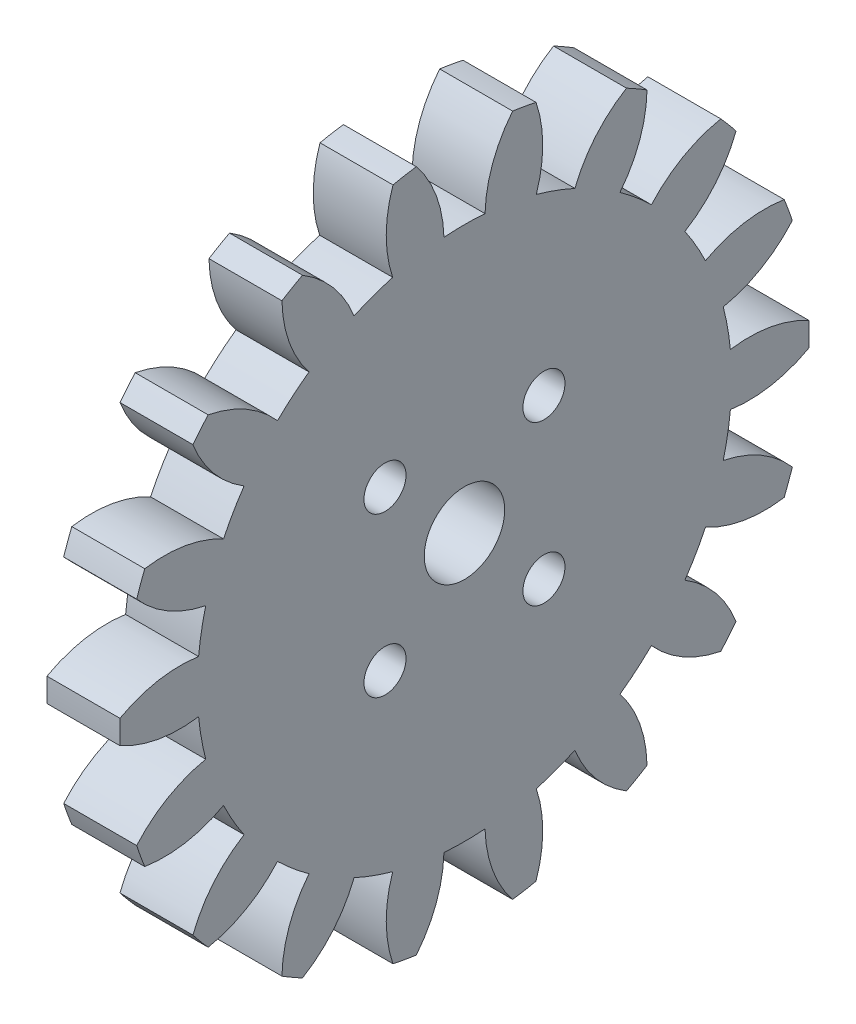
SolidWorks part; units mm, degrees
ref_plane "Plane1" through (0, 0, 0) normal (0, 0, 1) x (1, 0, 0)
ref_plane "Plane2" through (0, 0, 0) normal (0, 1, 0) x (1, 0, 0)
ref_plane "Plane3" through (0, 0, 0) normal (1, 0, 0) x (0, 0, -1)
sketch "HoldingSke" plane through (0, 0, 0) normal (0, 1, 0) x (1, 0, 0)
  line L0 (0, 0) -> (0.317, -0.103)
  line L1 (-15, 0) -> (100, 0) construction
  line L2 (0, 0) -> (-2.1039, 2.3779)
  line L3 (0, 0) -> (-11.863, 4.5341)
  line L4 (0, 0) -> (8.2133, 2.6687)
  line L5 (0, 0) -> (-46.8476, -17.4728)
  line L6 (0, 0) -> (-5.2639, -3.5516)
  line L7 (-2.1039, 2.3779) -> (8.6586, 51.2059)
  line L8 (-76.2, 54.61) -> (-75.2, 54.61)
  line L9 (-67.7845, 28.3722) -> (-49.3413, 33.142)
  line L10 (-76.2, 71.12) -> (104.1128, 71.12)
  line L11 (0, 0) -> (-6.35, 0)
  line L12 (-76.2, 101.6) -> (-76.093, 101.6)
  line L13 (24.9733, 27.94) -> (52.9518, 28.4284)
  line L14 (24.9733, 27.94) -> (24.9743, 27.94)
  line L15 (24.9733, 27.94) -> (100.4006, 29.5858)
  line L16 (-63.627, -3) -> (-12.827, -3)
  circle A0 centre (0, 0) radius 3.5
  circle A1 centre (0, 0) radius 23.249
  circle A2 centre (0, 0) radius 37.5
  circle A3 centre (0, 0) radius 3.5
sketch "BasProSke" plane through (0, 0, 0) normal (0, 1, 0) x (1, 0, 0)
  line L0 (-10, 0) -> (60, 0) construction
  line L1 (0, 0) -> (0, 30)
  line L2 (0, 0) -> (6.35, 0)
  line L3 (6.35, 0) -> (6.35, 30)
  line L4 (6.35, 30) -> (0, 30)
revolve "Base-Revolve" add sketch "BasProSke" angle 360 about L0
sketch "TooCutSke" plane through (0, 0, 0) normal (1, 0, 0) x (0, 0, -1)
  line L1 (0, 0) -> (0, 107) construction
  line L2 (0, 0) -> (-2.5403, 26.8802) construction
  line L3 (0, 0) -> (-9.3468, 53.0082) construction
  line L4 (-2.5403, 26.8802) -> (-4.6734, 26.5041) construction
  arc A0 (1.788, 23.1801) -> (-1.788, 23.1801) centre (0, 0) ccw
  arc A1 (4.2085, 29.729) -> (-4.2085, 29.729) centre (0, 0) ccw
  circle A2 centre (0, 0) radius 27 construction
  circle A3 centre (0, 0) radius 26.14 construction
  arc A4 (-1.788, 23.1801) -> (-4.2085, 29.729) centre (-12.5846, 22.9113) ccw
  arc A5 (4.2085, 29.729) -> (1.788, 23.1801) centre (12.5846, 22.9113) ccw
extrude "ToothCut" cut sketch "TooCutSke" along normal through all
fillet "Breaks" [suppressed] radius 0.06
fillet "RootFillets" [suppressed] radius 0.751
pattern_circular "TeethCuts" count 18 every 20 about axis through (-10, 0, 0) along (1, 0, 0) of "ToothCut", "RootFillets", "Breaks"
sketch "HubNeaOneSke" plane through (0, 0, 0) normal (-1, 0, 0) x (0, 0, 1)
  circle A0 centre (0, 0) radius 23.249
extrude "HubNearOne" [suppressed] add sketch "HubNeaOneSke" along normal blind 43.6501
sketch "HubNeaBotSke" plane through (0, 0, 0) normal (-1, 0, 0) x (0, 0, 1)
  circle A0 centre (0, 0) radius 23.249
extrude "HubNearBoth" [suppressed] add sketch "HubNeaBotSke" along normal blind 21.825
ref_plane "FarPln" through (6.35, 0, 0) normal (1, 0, 0) x (0, 0, -1)
sketch "HubFarSke" plane through (6.35, 0, 0) normal (1, 0, 0) x (0, 0, -1)
  circle A0 centre (0, 0) radius 23.249
extrude "HubFar" [suppressed] add sketch "HubFarSke" along normal blind 21.825
sketch "BorSke" plane through (0, 0, 0) normal (1, 0, 0) x (0, 0, -1)
  circle A0 centre (0, 0) radius 3.5
extrude "Bore" cut sketch "BorSke" along normal mid plane 100.0001
sketch "KeySke" plane through (0, 0, 0) normal (1, 0, 0) x (0, 0, -1)
  line L0 (-1, 0) -> (-1, 4.5)
  line L1 (-1, 4.5) -> (1, 4.5)
  line L2 (1, 4.5) -> (1, 0)
  line L3 (0, 0) -> (0, 34) construction
  line L4 (-1, 0) -> (1, 0)
extrude "Keyway" [suppressed] cut sketch "KeySke" along normal mid plane 100.0001
pattern_circular "Keyway2" [suppressed] count 2 every 90 about axis through (-10, 0, 0) along (1, 0, 0)
sketch "Esquisse1" plane through (0, 0, 0) normal (-1, 0, 0) x (0, 0, 1)
  circle A0 centre (-6.9148, 6.9148) radius 1.83
  dimension "D1" = 3.66
extrude "Enlèv. mat.-Extru.1" cut sketch "Esquisse1" against normal up to next
pattern_circular "Répétition circulaire1" count 4 over 360 about axis through (0, 0, 0) along (1, 0, 0) of "Enlèv. mat.-Extru.1"
equation "' \"Module@HoldingSke\" = 6.35"
equation "' \"Num_teeth@HoldingSke\" = 12"
equation "' \"Ap@HoldingSke\" =  20"
equation "' \"Ap@HoldingSke\" = 20"
equation "' \"Width@HoldingSke\" = 0.5 * 25.4"
equation "' \"Hub_dia@HoldingSke\"= 1 * 25.4"
equation "' \"Hub_dia@HoldingSke\" = 1 * 25.4"
equation "' \"Overall_len@HoldingSke\" = 1.0 * 25.4"
equation "' \"Bore@HoldingSke\" = 0.75 * 25.4"
equation "' \"T_dim@HoldingSke\" = 0.1 * 25.4"
equation "' \"Width@KeySke\" = 0.25 * 25.4"
equation "' \"Show_teeth@HoldingSke\" = 13"
equation "' \"Backlash@HoldingSke\" = 0.009 * 25.4"
equation "' \"Addendum_fac@HoldingSke\" = 1.0"
equation "' \"Dedendum_fac@HoldingSke\" = 1.25"
equation "' \"Dedendum_add@HoldingSke\" = 0.00005 * 25.4"
equation "' \"Clearance_fac@HoldingSke\" = 0.25"
equation "\"Pitch@HoldingSke\" = 1 / \"Module@HoldingSke\""
equation "\"Overcut_dia@TooCutSke\" = (\"Num_teeth@HoldingSke\" + 2 * \"Addendum_fac@HoldingSke\") / \"Pitch@HoldingSke\" + 0.002 * 25.4"
equation "\"Pitch_dia@TooCutSke\" = \"Num_teeth@HoldingSke\" / \"Pitch@HoldingSke\""
equation "\"Base_dia@TooCutSke\" = \"Num_teeth@HoldingSke\" / \"Pitch@HoldingSke\" * cos((\"Ap@HoldingSke\"  * 3.14159265 / 180))"
equation "\"Root_dia@TooCutSke\" = (\"Num_teeth@HoldingSke\" + 2) / \"Pitch@HoldingSke\" - 2 * (\"Addendum_fac@HoldingSke\" + \"Dedendum_fac@HoldingSke\") / \"Pitch@HoldingSke\" - \"Dedendum_add@HoldingSke\" * 2"
equation "\"Half_ang@TooCutSke\" = 180 / \"Num_teeth@HoldingSke\""
equation "\"Half_CT@TooCutSke\" = \"Num_teeth@HoldingSke\" / \"Pitch@HoldingSke\" * sin((3.14159265 / 2 / \"Num_teeth@HoldingSke\")) / 2 - 7 * \"Backlash@HoldingSke\" / 4"
equation "\"Flank_rad@TooCutSke\" = \"Num_teeth@HoldingSke\" / \"Pitch@HoldingSke\" / 5"
equation "\"Radius@RootFillets\" = \"Clearance_fac@HoldingSke\" / \"Pitch@HoldingSke\" + \"Dedendum_add@HoldingSke\""
equation "\"Break_rad@Breaks\" = 0.02 / \"Pitch@HoldingSke\""
equation "\"Thickness@HoldingSke\" = \"Width@HoldingSke\""
equation "\"OAL@HoldingSke\" = \"Thickness@HoldingSke\""
equation "\"MHD@HoldingSke\" = (\"Num_teeth@HoldingSke\" + 2) / \"Pitch@HoldingSke\" - 2 * (\"Addendum_fac@HoldingSke\" + \"Dedendum_fac@HoldingSke\")  / \"Pitch@HoldingSke\" - \"Dedendum_add@HoldingSke\" * 2"
equation "\"MBD@HoldingSke\" = (\"Num_teeth@HoldingSke\" + 2) / \"Pitch@HoldingSke\" - 2 * (\"Addendum_fac@HoldingSke\" + \"Dedendum_fac@HoldingSke\")  / \"Pitch@HoldingSke\" - \"Dedendum_add@HoldingSke\" * 2 - 0.002 * 25.4"
equation "\"MHD@HoldingSke\" = ((sgn( \"MHD@HoldingSke\" - \"Hub_dia@HoldingSke\" )-1)*( \"MHD@HoldingSke\" - \"Hub_dia@HoldingSke\" ))/-2+ \"Hub_dia@HoldingSke\""
equation "\"MBD@HoldingSke\" = ((sgn( \"MBD@HoldingSke\" - \"Bore@HoldingSke\" )-1)*( \"MBD@HoldingSke\" - \"Bore@HoldingSke\" ))/-2+ \"Bore@HoldingSke\""
equation "\"OAL@HoldingSke\" = ((sgn( \"OAL@HoldingSke\" - \"Overall_len@HoldingSke\" )+1)*( \"OAL@HoldingSke\" - \"Overall_len@HoldingSke\" ))/2 + \"Overall_len@HoldingSke\" + 0.000002 * 25.4"
equation "\"Num_teeth@TeethCuts\" = int( \"Show_teeth@HoldingSke\" ) + 1"
equation "\"Num_teeth@TeethCuts\" = ((sgn( \"Num_teeth@TeethCuts\" - \"Num_teeth@HoldingSke\" )-1)*( \"Num_teeth@TeethCuts\" - \"Num_teeth@HoldingSke\" ))/-2+ \"Num_teeth@HoldingSke\""
equation "\"Num_teeth@TeethCuts\" = ((sgn( \"Num_teeth@TeethCuts\" - 2.0)+1)*( \"Num_teeth@TeethCuts\" - 2.0))/2 +2.0"
equation "\"Angle@TeethCuts\" = 360.0 / \"Num_teeth@HoldingSke\""
equation "\"Diameter@BasProSke\" = (\"Num_teeth@HoldingSke\" + 2 * \"Addendum_fac@HoldingSke\") / \"Pitch@HoldingSke\""
equation "\"Thickness@BasProSke\"  = \"Thickness@HoldingSke\""
equation "' \"Fillet_rad@BasProSke\" =  \"Thickness@HoldingSke\" * 0.05"
equation "' \"Fillet_rad@BasProSke\" = \"Thickness@HoldingSke\" * 0.05"
equation "\"MHD@HoldingSke\" = ((sgn( \"MHD@HoldingSke\" - \"Root_dia@TooCutSke\" )-1)*( \"MHD@HoldingSke\" - \"Root_dia@TooCutSke\" ))/-2+ \"Root_dia@TooCutSke\""
equation "\"Diameter@HubNeaOneSke\" = \"MHD@HoldingSke\""
equation "\"Length@HubNearOne\" = \"OAL@HoldingSke\" - \"Thickness@BasProSke\""
equation "\"Diameter@HubNeaBotSke\" = \"MHD@HoldingSke\""
equation "\"Length@HubNearBoth\" = ( \"OAL@HoldingSke\" - \"Thickness@BasProSke\" ) / 2.0"
equation "\"Thickness@FarPln\" = \"Thickness@BasProSke\""
equation "\"Diameter@HubFarSke\" = \"MHD@HoldingSke\""
equation "\"Length@HubFar\" = ( \"OAL@HoldingSke\" - \"Thickness@BasProSke\" ) / 2.0"
equation "\"Diameter@BorSke\" = \"MBD@HoldingSke\""
equation "\"D1@Bore\" = \"OAL@HoldingSke\" * 2.0"
equation "\"D1@Keyway\" = \"OAL@HoldingSke\" * 2.0"
equation "\"Offset@KeySke\" = \"T_dim@HoldingSke\" + \"MBD@HoldingSke\" / 2.0"
